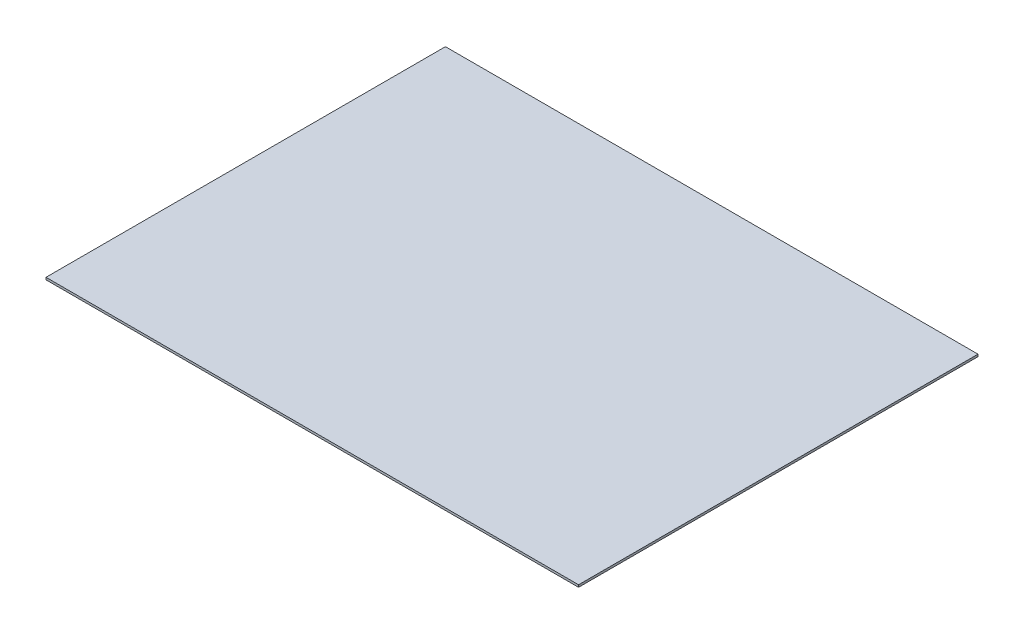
SolidWorks part; units mm, degrees
ref_plane "Front Plane" through (0, 0, 0) normal (0, 0, 1) x (1, 0, 0)
ref_plane "Top Plane" through (0, 0, 0) normal (0, 1, 0) x (1, 0, 0)
ref_plane "Right Plane" through (0, 0, 0) normal (1, 0, 0) x (0, 0, -1)
sketch "Sketch1" plane through (0, 0, 0) normal (0, 1, 0) x (1, 0, 0)
  line L1 (-1200, 900) -> (1200, 900)
  line L2 (-1200, 900) -> (-1200, -900)
  line L3 (-1200, -900) -> (1200, -900)
  line L4 (1200, 900) -> (1200, -900)
  line L5 (-1200, 900) -> (1200, -900) construction
  line L6 (-1200, -900) -> (1200, 900) construction
  point P0 (0, 0)
  dimension "D1" = 2400
  dimension "D2" = 1800
extrude "Boss-Extrude1" add sketch "Sketch1" along normal blind 10
